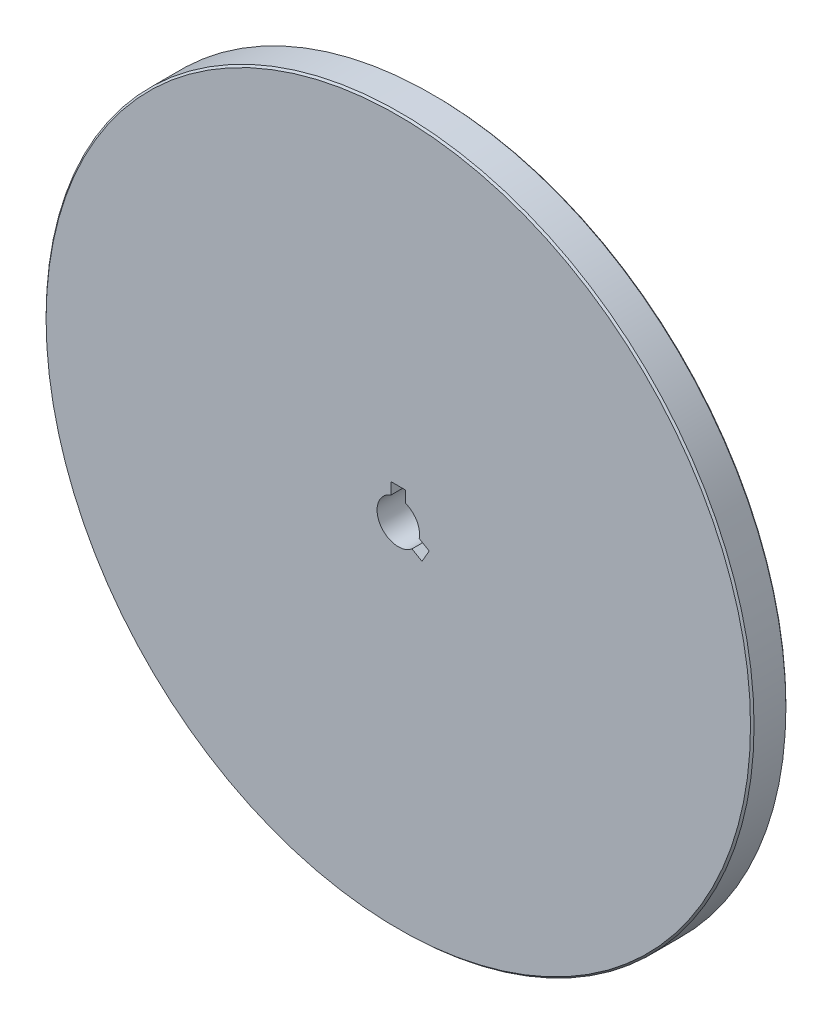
SolidWorks part; units mm, degrees
ref_plane "Face" through (0, 0, 0) normal (0, 0, 1) x (1, 0, 0)
ref_plane "Dessus" through (0, 0, 0) normal (0, 1, 0) x (1, 0, 0)
ref_plane "Droite" through (0, 0, 0) normal (1, 0, 0) x (0, 0, -1)
sketch "Esquisse1" plane through (0, 0, 0) normal (0, 0, 1) x (1, 0, 0)
  circle A0 centre (0, 0) radius 6
  circle A1 centre (0, 0) radius 100
  dimension "D1" = 12
  dimension "D2" = 200
extrude "Extrusion1" add sketch "Esquisse1" along normal blind 10
sketch "Esquisse2" plane through (0, 0, 10) normal (0, 0, 1) x (1, 0, 0)
  line L0 (10.853, 61.5505) -> (0, 0) construction
  line L1 (0, 0) -> (10.853, -61.5505) construction
  line L2 (0, 0) -> (117.0528, 0) construction
  arc A0 (14.326, -81.2466) -> (14.326, 81.2466) centre (0, 0) ccw
  circle A1 centre (0, 0) radius 62.5 construction
  arc A2 (7.38, -41.8543) -> (7.38, 41.8543) centre (0, 0) ccw
  arc A3 (14.326, 81.2466) -> (7.38, 41.8543) centre (10.853, 61.5505) ccw
  arc A4 (7.38, -41.8543) -> (14.326, -81.2466) centre (10.853, -61.5505) ccw
  dimension "D3" = 125
  dimension "D4" = 20
  dimension "D1" = 80
  dimension "D2" = 80
extrude "Enlèv. mat.-Extru.1" cut sketch "Esquisse2" against normal through all
chamfer "Chanfrein1" distance 0.5 angle 45 2 edges at (100, 0, 0) (100, 0, 10)
sketch "Esquisse3" plane through (0, 0, 10) normal (0, 0, 1) x (1, 0, 0)
  line L0 (0, 0) -> (0, 13.9863) construction
  line L1 (-2.05, 5.6389) -> (-2.05, 8.9)
  line L2 (-2.05, 8.9) -> (2.05, 8.9)
  line L3 (2.05, 5.6389) -> (2.05, 8.9)
  circle A0 centre (0, 0) radius 6 construction
  arc A1 (2.05, 5.6389) -> (-2.05, 5.6389) centre (0, 0) ccw
  point P10 (0, 8.9)
  dimension "D1" = 4.1
  dimension "D2" = 14.9
extrude "Enlèv. mat.-Extru.2" cut sketch "Esquisse3" against normal through all
pattern_circular "Répétition circulaire1" count 2 over 120 about axis through (0, 0, 0) along (0, 0, 1) of "Enlèv. mat.-Extru.2"
